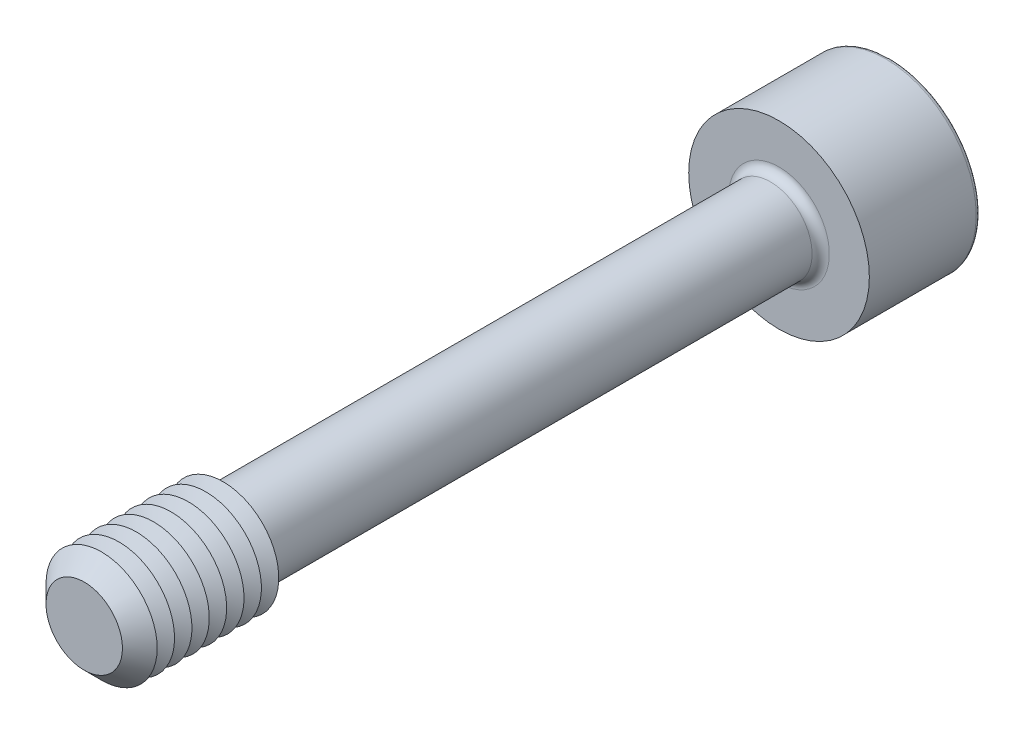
SolidWorks part; units mm, degrees
ref_plane "Front Plane" through (0, 0, 0) normal (0, 0, 1) x (1, 0, 0)
ref_plane "Top Plane" through (0, 0, 0) normal (0, 1, 0) x (1, 0, 0)
ref_plane "Right Plane" through (0, 0, 0) normal (1, 0, 0) x (0, 0, -1)
sketch "Sketch1" plane through (0, 0, 0) normal (0, 0, 1) x (1, 0, 0)
  circle A0 centre (0, 0) radius 3
  dimension "D1" = 6
extrude "Extrude1" add sketch "Sketch1" along normal mid plane 50
sketch "Sketch2" plane through (0, 0, 0) normal (1, 0, 0) x (0, 0, -1)
  line L0 (-25, 0) -> (-25, 4)
  line L1 (-25, 3) -> (-25, -3) construction
  line L2 (-25, 4) -> (-15, 4)
  line L3 (-15, 4) -> (-14.4226, 3)
  line L4 (25, 3) -> (-25, 3) construction
  line L5 (-14.4226, 3) -> (-14.4226, 0)
  line L6 (-14.4226, 0) -> (-25, 0)
  dimension "D1" = 4
  dimension "D2" = 120
  dimension "D3" = 10
revolve "Revolve1" add sketch "Sketch2" angle 360 about L6
chamfer "Chamfer1" distance 1.25 angle 45 1 edges at (0, 4, 25)
sketch "Sketch3" plane through (0, 0, -25) normal (0, 0, -1) x (-1, 0, 0)
  circle A0 centre (0, 0) radius 6.5
  dimension "D1" = 13
extrude "Extrude2" add sketch "Sketch3" along normal blind 8
sketch "Sketch4" plane through (-13.7, 0, -33) normal (0, 0, 1) x (1, 0, 0)
  line L2 (11.9679, -3) -> (15.4321, -3)
  line L3 (15.4321, -3) -> (17.1641, 0)
  line L4 (17.1641, 0) -> (15.4321, 3)
  line L6 (15.4321, 3) -> (11.9679, 3)
  line L7 (11.9679, 3) -> (10.2359, 0)
  line L8 (10.2359, 0) -> (11.9679, -3)
  circle A0 centre (13.7, 0) radius 3 construction
  dimension "D1" = 6
extrude "Extrude3" cut sketch "Sketch4" along normal blind 6
fillet "Fillet1" radius 0.62 1 edges at (-3, 0, -25)
fillet "Fillet2" radius 0.31 1 edges at (-6.5, 0, -33)
sketch "Sketch5" plane through (0, 0, 0) normal (1, 0, 0) x (0, 0, -1)
  line L0 (27, 0) -> (27, -3)
  line L1 (27, -3) -> (25.2679, 0)
  line L2 (25.2679, 0) -> (27, 0)
  dimension "D1" = 30
revolve "Cut-Revolve1" cut sketch "Sketch5" angle 360 about L2
sketch "Sketch6" plane through (0, 0, 0) normal (1, 0, 0) x (0, 0, -1)
  line L0 (1.332, 0) -> (-13.289, 0) construction
sketch "Sketch7" plane through (0, 0, 0) normal (1, 0, 0) x (0, 0, -1)
  line L0 (-15, 4) -> (-15.625, 2.9175)
  line L1 (-15.625, 2.9175) -> (-16.25, 4)
  line L2 (-15, 4) -> (-23.75, 4) construction
  line L3 (-16.25, 4) -> (-15, 4)
  dimension "D1" = 1.25
revolve "Cut-Revolve2" cut sketch "Sketch7" angle 360 about L0
pattern_linear "LPattern1" count 7 spacing 1.25 along (0, 0, 1) of "Cut-Revolve2"
